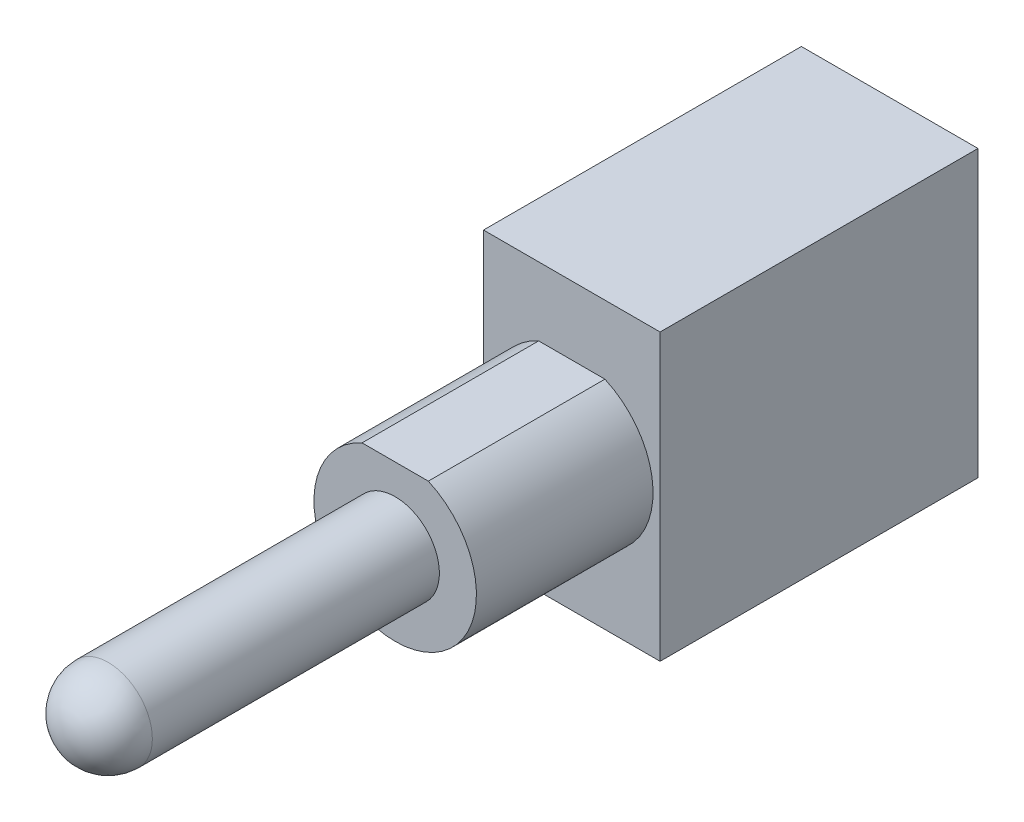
SolidWorks part; units mm, degrees
ref_plane "Front Plane" through (0, 0, 0) normal (0, 0, 1) x (1, 0, 0)
ref_plane "Top Plane" through (0, 0, 0) normal (0, 1, 0) x (1, 0, 0)
ref_plane "Right Plane" through (0, 0, 0) normal (1, 0, 0) x (0, 0, -1)
sketch "Sketch1" plane through (0, 0, 0) normal (1, 0, 0) x (0, 0, -1)
  line L0 (4.572, 4.1021) -> (-4.572, -4.1021) construction
  line L1 (-4.572, 4.1021) -> (4.572, 4.1021)
  line L2 (-4.572, 4.1021) -> (-4.572, -4.1021)
  line L3 (-4.572, -4.1021) -> (4.572, -4.1021)
  line L4 (4.572, 4.1021) -> (4.572, -4.1021)
  point P4 (0, 0)
  dimension "D1" = 9.144
  dimension "D2" = 8.2042
extrude "Boss-Extrude1" add sketch "Sketch1" along normal blind 5.08
sketch "Sketch2" plane through (0, 0, 4.572) normal (0, 0, 1) x (1, 0, 0)
  line L0 (5.08, 4.1021) -> (0, 4.1021) construction
  line L1 (5.08, 4.1021) -> (5.08, -4.1021) construction
  circle A0 centre (2.54, 0) radius 2.3368
  point P4 (2.54, 4.1021)
  point P7 (5.08, 0)
  dimension "D1" = 4.6736
extrude "Boss-Extrude2" add sketch "Sketch2" along normal blind 5.08
sketch "Sketch3" plane through (0, 0, 9.652) normal (0, 0, 1) x (1, 0, 0)
  circle A0 centre (2.54, 0) radius 1.27
  circle A1 centre (2.54, 0) radius 2.3368 construction
  dimension "D1" = 2.54
extrude "Boss-Extrude3" add sketch "Sketch3" along normal blind 9.525
fillet "Fillet1" radius 1.27
sketch "Sketch4" plane through (0, 0, 9.652) normal (0, 0, 1) x (1, 0, 0)
  line L0 (1.5869, 2.1336) -> (3.4931, 2.1336)
  line L1 (3.4931, 2.1336) -> (3.4931, 2.7232)
  line L2 (3.4931, 2.7232) -> (1.5869, 2.7232)
  line L3 (1.5869, 2.7232) -> (1.5869, 2.1336)
  line L4 (5.08, 4.1021) -> (0, 4.1021) construction
  line L5 (5.08, -4.1021) -> (0, -4.1021) construction
  circle A0 centre (2.54, 0) radius 2.3368 construction
  point P8 (2.54, 4.1021)
  point P9 (2.54, 2.7232)
  dimension "D1" = 6.2357
  dimension "D2" = 0.5896
extrude "Cut-Extrude1" cut sketch "Sketch4" against normal up to surface (5.08 mm away)
